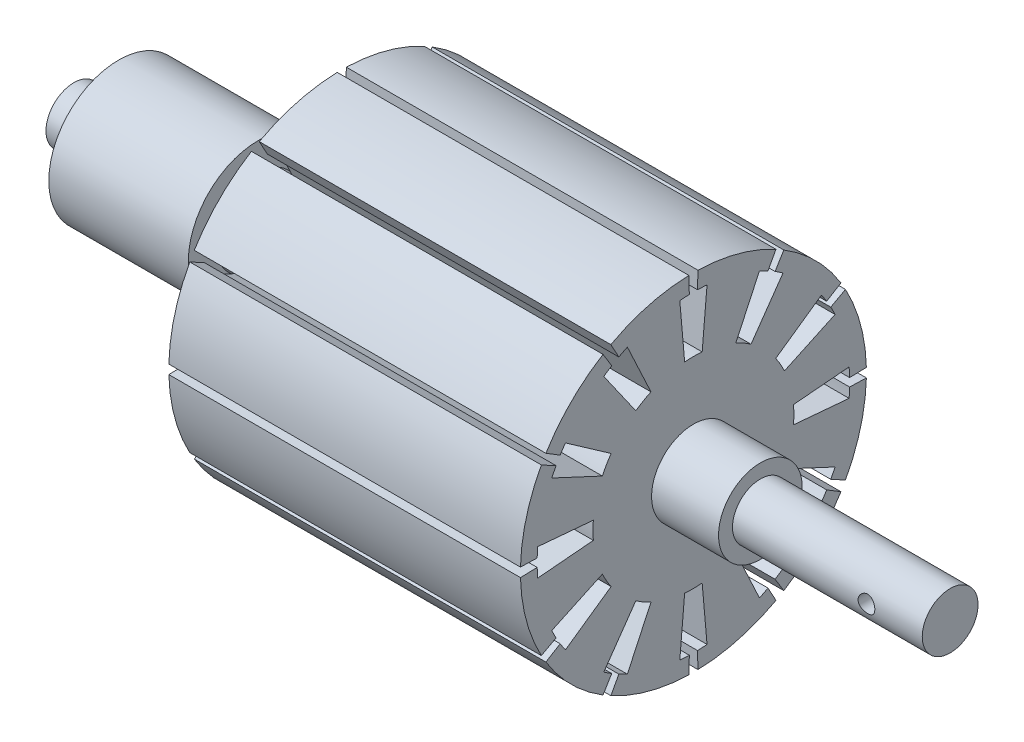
SolidWorks part; units mm, degrees
ref_plane "Face" through (0, 0, 0) normal (0, 0, 1) x (1, 0, 0)
ref_plane "Dessus" through (0, 0, 0) normal (0, 1, 0) x (1, 0, 0)
ref_plane "Droite" through (0, 0, 0) normal (1, 0, 0) x (0, 0, -1)
sketch "Esquisse1" plane through (0, 0, 0) normal (0, 0, 1) x (1, 0, 0)
  line L0 (-48, 0) -> (97.0924, 0) construction
  line L1 (-48, 0) -> (-48, 5)
  line L2 (-48, 5) -> (-40, 5)
  line L3 (-40, 5) -> (-40, 12.5)
  line L4 (-40, 12.5) -> (-15, 12.5)
  line L5 (-15, 12.5) -> (-15, 7.5)
  line L6 (-15, 7.5) -> (0, 7.5)
  line L7 (0, 7.5) -> (0, 31)
  line L8 (0, 31) -> (63, 31)
  line L9 (63, 31) -> (63, 7.5)
  line L10 (63, 7.5) -> (75, 7.5)
  line L11 (75, 7.5) -> (75, 5)
  line L12 (75, 5) -> (109, 5)
  line L13 (109, 5) -> (109, 0)
  line L14 (-48, 0) -> (109, 0)
  dimension "D1" = 8
  dimension "D2" = 25
  dimension "D3" = 15
  dimension "D4" = 63
  dimension "D5" = 12
  dimension "D6" = 34
  dimension "D7" = 5
  dimension "D8" = 10
  dimension "D9" = 25
  dimension "D10" = 15
  dimension "D11" = 62
  dimension "D12" = 15
  dimension "D13" = 15
revolve "Base-Révolution" add sketch "Esquisse1" angle 360 about L0
sketch "Esquisse2" plane through (63, 0, 0) normal (1, 0, 0) x (0, 0, -1)
  line L0 (0, 34.8901) -> (0, -35.7323) construction
  line L1 (-36.1534, 0) -> (36.394, 0) construction
  line L2 (0, 0) -> (-8.9052, 33.2347) construction
  line L3 (0, 0) -> (8.9675, 33.4671) construction
  line L4 (0, 0) -> (-2.7018, 30.882) construction
  line L5 (0, 0) -> (2.7018, 30.882) construction
  line L6 (0, 0) -> (1.0403, 39.7277) construction
  line L7 (0, 0) -> (-1.0406, 39.738) construction
  line L8 (-1.5688, 17.9315) -> (-2.4404, 27.8935)
  line L9 (1.5688, 17.9315) -> (2.4404, 27.8935)
  line L10 (-0.733, 27.9904) -> (-0.8417, 32.1431)
  line L11 (0.8417, 32.1431) -> (0.733, 27.9904)
  line L12 (13.3604, 24.6069) -> (15.3426, 28.2576)
  line L13 (16.8005, 27.4159) -> (14.63, 23.8739)
  line L14 (10.3244, 14.7447) -> (16.0601, 22.9363)
  line L15 (7.6071, 16.3135) -> (11.8333, 25.3766)
  line L16 (23.8739, 14.63) -> (27.4159, 16.8005)
  line L17 (28.2576, 15.3426) -> (24.6069, 13.3604)
  line L18 (16.3135, 7.6071) -> (25.3766, 11.8333)
  line L19 (14.7447, 10.3244) -> (22.9363, 16.0601)
  line L20 (27.9904, 0.733) -> (32.1431, 0.8417)
  line L21 (32.1431, -0.8417) -> (27.9904, -0.733)
  line L22 (17.9315, -1.5688) -> (27.8935, -2.4404)
  line L23 (17.9315, 1.5688) -> (27.8935, 2.4404)
  line L24 (24.6069, -13.3604) -> (28.2576, -15.3426)
  line L25 (27.4159, -16.8005) -> (23.8739, -14.63)
  line L26 (14.7447, -10.3244) -> (22.9363, -16.0601)
  line L27 (16.3135, -7.6071) -> (25.3766, -11.8333)
  line L28 (14.63, -23.8739) -> (16.8005, -27.4159)
  line L29 (15.3426, -28.2576) -> (13.3604, -24.6069)
  line L30 (7.6071, -16.3135) -> (11.8333, -25.3766)
  line L31 (10.3244, -14.7447) -> (16.0601, -22.9363)
  line L32 (0.733, -27.9904) -> (0.8417, -32.1431)
  line L33 (-0.8417, -32.1431) -> (-0.733, -27.9904)
  line L34 (-1.5688, -17.9315) -> (-2.4404, -27.8935)
  line L35 (1.5688, -17.9315) -> (2.4404, -27.8935)
  line L36 (-13.3604, -24.6069) -> (-15.3426, -28.2576)
  line L37 (-16.8005, -27.4159) -> (-14.63, -23.8739)
  line L38 (-10.3244, -14.7447) -> (-16.0601, -22.9363)
  line L39 (-7.6071, -16.3135) -> (-11.8333, -25.3766)
  line L40 (-23.8739, -14.63) -> (-27.4159, -16.8005)
  line L41 (-28.2576, -15.3426) -> (-24.6069, -13.3604)
  line L42 (-16.3135, -7.6071) -> (-25.3766, -11.8333)
  line L43 (-14.7447, -10.3244) -> (-22.9363, -16.0601)
  line L44 (-27.9904, -0.733) -> (-32.1431, -0.8417)
  line L45 (-32.1431, 0.8417) -> (-27.9904, 0.733)
  line L46 (-17.9315, 1.5688) -> (-27.8935, 2.4404)
  line L47 (-17.9315, -1.5688) -> (-27.8935, -2.4404)
  line L48 (-24.6069, 13.3604) -> (-28.2576, 15.3426)
  line L49 (-27.4159, 16.8005) -> (-23.8739, 14.63)
  line L50 (-14.7447, 10.3244) -> (-22.9363, 16.0601)
  line L51 (-16.3135, 7.6071) -> (-25.3766, 11.8333)
  line L52 (-14.63, 23.8739) -> (-16.8005, 27.4159)
  line L53 (-15.3426, 28.2576) -> (-13.3604, 24.6069)
  line L54 (-7.6071, 16.3135) -> (-11.8333, 25.3766)
  line L55 (-10.3244, 14.7447) -> (-16.0601, 22.9363)
  arc A0 (-0.733, 27.9904) -> (-2.4404, 27.8935) centre (0, 0) ccw
  arc A1 (16.8005, 27.4159) -> (15.3426, 28.2576) centre (0, 0) ccw
  arc A2 (13.3604, 24.6069) -> (11.8333, 25.3766) centre (0, 0) ccw
  circle A3 centre (0, 0) radius 31 construction
  arc A4 (2.4404, 27.8935) -> (0.733, 27.9904) centre (0, 0) ccw
  arc A5 (1.5688, 17.9315) -> (-1.5688, 17.9315) centre (0, 0) ccw
  arc A6 (16.0601, 22.9363) -> (14.63, 23.8739) centre (0, 0) ccw
  arc A7 (0.8417, 32.1431) -> (-0.8417, 32.1431) centre (0, 0) ccw
  arc A8 (10.3244, 14.7447) -> (7.6071, 16.3135) centre (0, 0) ccw
  arc A9 (28.2576, 15.3426) -> (27.4159, 16.8005) centre (0, 0) ccw
  arc A10 (23.8739, 14.63) -> (22.9363, 16.0601) centre (0, 0) ccw
  arc A11 (25.3766, 11.8333) -> (24.6069, 13.3604) centre (0, 0) ccw
  arc A12 (16.3135, 7.6071) -> (14.7447, 10.3244) centre (0, 0) ccw
  arc A13 (32.1431, -0.8417) -> (32.1431, 0.8417) centre (0, 0) ccw
  arc A14 (27.9904, 0.733) -> (27.8935, 2.4404) centre (0, 0) ccw
  arc A15 (27.8935, -2.4404) -> (27.9904, -0.733) centre (0, 0) ccw
  arc A16 (17.9315, -1.5688) -> (17.9315, 1.5688) centre (0, 0) ccw
  arc A17 (27.4159, -16.8005) -> (28.2576, -15.3426) centre (0, 0) ccw
  arc A18 (24.6069, -13.3604) -> (25.3766, -11.8333) centre (0, 0) ccw
  arc A19 (22.9363, -16.0601) -> (23.8739, -14.63) centre (0, 0) ccw
  arc A20 (14.7447, -10.3244) -> (16.3135, -7.6071) centre (0, 0) ccw
  arc A21 (15.3426, -28.2576) -> (16.8005, -27.4159) centre (0, 0) ccw
  arc A22 (14.63, -23.8739) -> (16.0601, -22.9363) centre (0, 0) ccw
  arc A23 (11.8333, -25.3766) -> (13.3604, -24.6069) centre (0, 0) ccw
  arc A24 (7.6071, -16.3135) -> (10.3244, -14.7447) centre (0, 0) ccw
  arc A25 (-0.8417, -32.1431) -> (0.8417, -32.1431) centre (0, 0) ccw
  arc A26 (0.733, -27.9904) -> (2.4404, -27.8935) centre (0, 0) ccw
  arc A27 (-2.4404, -27.8935) -> (-0.733, -27.9904) centre (0, 0) ccw
  arc A28 (-1.5688, -17.9315) -> (1.5688, -17.9315) centre (0, 0) ccw
  arc A29 (-16.8005, -27.4159) -> (-15.3426, -28.2576) centre (0, 0) ccw
  arc A30 (-13.3604, -24.6069) -> (-11.8333, -25.3766) centre (0, 0) ccw
  arc A31 (-16.0601, -22.9363) -> (-14.63, -23.8739) centre (0, 0) ccw
  arc A32 (-10.3244, -14.7447) -> (-7.6071, -16.3135) centre (0, 0) ccw
  arc A33 (-28.2576, -15.3426) -> (-27.4159, -16.8005) centre (0, 0) ccw
  arc A34 (-23.8739, -14.63) -> (-22.9363, -16.0601) centre (0, 0) ccw
  arc A35 (-25.3766, -11.8333) -> (-24.6069, -13.3604) centre (0, 0) ccw
  arc A36 (-16.3135, -7.6071) -> (-14.7447, -10.3244) centre (0, 0) ccw
  arc A37 (-32.1431, 0.8417) -> (-32.1431, -0.8417) centre (0, 0) ccw
  arc A38 (-27.9904, -0.733) -> (-27.8935, -2.4404) centre (0, 0) ccw
  arc A39 (-27.8935, 2.4404) -> (-27.9904, 0.733) centre (0, 0) ccw
  arc A40 (-17.9315, 1.5688) -> (-17.9315, -1.5688) centre (0, 0) ccw
  arc A41 (-27.4159, 16.8005) -> (-28.2576, 15.3426) centre (0, 0) ccw
  arc A42 (-24.6069, 13.3604) -> (-25.3766, 11.8333) centre (0, 0) ccw
  arc A43 (-22.9363, 16.0601) -> (-23.8739, 14.63) centre (0, 0) ccw
  arc A44 (-14.7447, 10.3244) -> (-16.3135, 7.6071) centre (0, 0) ccw
  arc A45 (-15.3426, 28.2576) -> (-16.8005, 27.4159) centre (0, 0) ccw
  arc A46 (-14.63, 23.8739) -> (-16.0601, 22.9363) centre (0, 0) ccw
  arc A47 (-11.8333, 25.3766) -> (-13.3604, 24.6069) centre (0, 0) ccw
  arc A48 (-7.6071, 16.3135) -> (-10.3244, 14.7447) centre (0, 0) ccw
  dimension "D1" = 56
  dimension "D3" = 15
  dimension "D4" = 15
  dimension "D5" = 1.5
  dimension "D6" = 1.5
  dimension "D7" = 5
  dimension "D8" = 5
extrude "Enlèv. mat.-Extru.1" cut sketch "Esquisse2" against normal blind 64.9984
sketch "Esquisse3" plane through (0, 0, 0) normal (0, 0, 1) x (1, 0, 0)
  line L0 (0, 0) -> (135.0303, 0) construction
  line L1 (99, 70.2709) -> (99, -75.0943) construction
  circle A0 centre (99, 0) radius 1.5
  dimension "D2" = 3
  dimension "D1" = 36
extrude "Enlèv. mat.-Extru.2" cut sketch "Esquisse3" against normal mid plane 10
